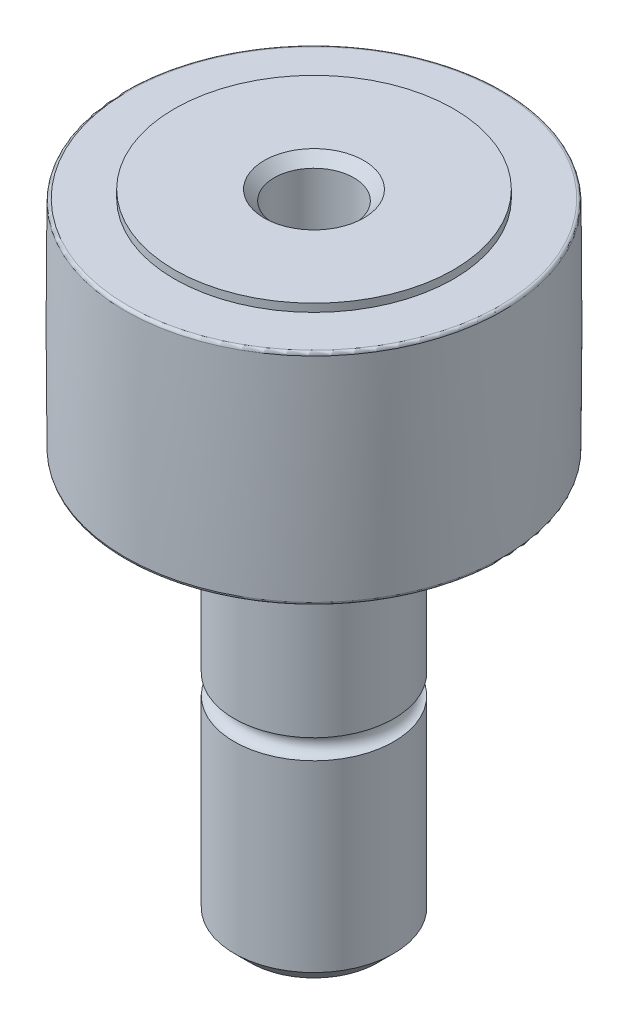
SolidWorks part; units mm, degrees
ref_plane "Plan1" through (0, 0, 0) normal (0, 0, 1) x (1, 0, 0)
ref_plane "Plan2" through (0, 0, 0) normal (0, 1, 0) x (1, 0, 0)
ref_plane "Plan3" through (0, 0, 0) normal (1, 0, 0) x (0, 0, -1)
sketch "Esquisse1" plane through (0, 0, 0) normal (0, 0, 1) x (1, 0, 0)
  line L0 (0, -6.8903) -> (0, 44.0974) construction
  line L1 (0, 0) -> (4, 0)
  line L2 (4, 0) -> (4, 10)
  line L3 (4, 20) -> (7, 20)
  line L4 (7, 20) -> (7, 20.6)
  line L5 (7, 20.6) -> (9.4697, 20.6)
  line L6 (4, 11) -> (4, 20)
  line L7 (9.4697, 31.6) -> (7, 31.6)
  line L8 (7, 31.6) -> (7, 32)
  line L9 (7, 32) -> (0, 32)
  line L10 (0, 32) -> (0, 0)
  arc A0 (9.4697, 31.6) -> (9.4697, 20.6) centre (-490.5, 26.1) cw
  arc A1 (4, 11) -> (4, 10) centre (4, 10.5) ccw
  dimension "D5" = 500
  dimension "D9" = 9.5
  dimension "D11" = 0.5
  dimension "D1" = 11
  dimension "D2" = 20
  dimension "D3" = 4
  dimension "D4" = 7
  dimension "D6" = 0.6
  dimension "D7" = 32
  dimension "D8" = 5.5
  dimension "D10" = 10
revolve "Base-Révolution" add sketch "Esquisse1" angle 360 about L0
chamfer "Chanfrein1" distance 0.8 angle 45
hole_wizard "Perçage1" positions "Esquisse3" profile "Esquisse2" legacy
sketch "Esquisse3" plane through (0, 32, 0) normal (0, 1, 0) x (-1, 0, 0)
  point P0 (0, 0)
sketch "Esquisse2" plane through (0, 32, 0) normal (1, 0, 0) x (0, 0, 1)
  line L0 (0, 0) -> (0, 10.866)
  line L1 (0, 10.866) -> (1.5, 10)
  line L2 (1.5, 10) -> (1.5, 0)
  line L4 (1.5, 0) -> (0, 0)
  line L6 (0, 10.866) -> (-1.5, 10) construction
  line L7 (0, -4.2442) -> (0, 117.3081) construction
  dimension "Diamètre" = 3
  dimension "Profondeur" = 10
  dimension "Angle" = 120
hole_wizard "Perçage2" positions "Esquisse5" profile "Esquisse4" legacy
sketch "Esquisse5" plane through (0, 32, 0) normal (0, 1, 0) x (-1, 0, 0)
  point P0 (0, 0)
sketch "Esquisse4" plane through (0, 32, 0) normal (1, 0, 0) x (0, 0, 1)
  line L0 (0, 0) -> (0, 7.1547)
  line L1 (0, 7.1547) -> (2, 6)
  line L2 (2, 6) -> (2, 0)
  line L4 (2, 0) -> (0, 0)
  line L6 (0, 7.1547) -> (-2, 6) construction
  line L7 (0, -4.2442) -> (0, 117.3081) construction
  dimension "Diamètre" = 4
  dimension "Profondeur" = 6
  dimension "Angle" = 120
fillet "Congé1" radius 0.15
chamfer "Chanfrein2" distance 0.5 angle 45
